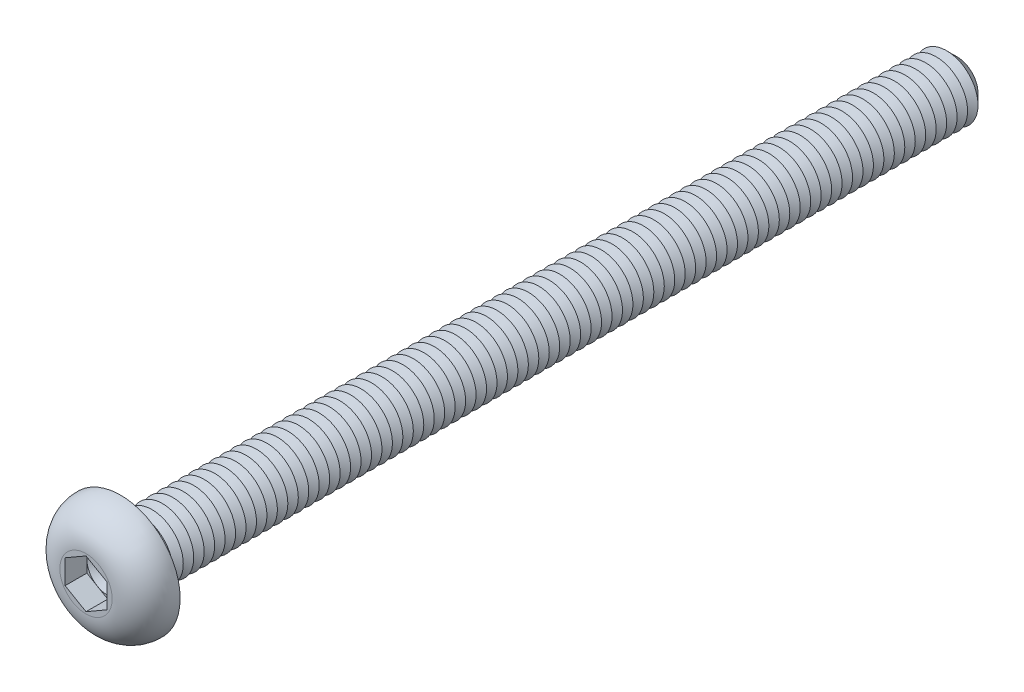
SolidWorks part; units mm, degrees
ref_plane "Front Plane" through (0, 0, 0) normal (0, 0, 1) x (1, 0, 0)
ref_plane "Top Plane" through (0, 0, 0) normal (0, 1, 0) x (1, 0, 0)
ref_plane "Right Plane" through (0, 0, 0) normal (1, 0, 0) x (0, 0, -1)
sketch "Sketch1" plane through (0, 0, 0) normal (1, 0, 0) x (0, 0, -1)
  line L0 (-47.9342, 0) -> (60.3146, 0) construction
sketch "Sketch2" plane through (0, 0, 0) normal (1, 0, 0) x (0, 0, -1)
  line L0 (0, 0) -> (-1.65, 0)
  line L1 (-47.9342, 0) -> (60.3146, 0) construction
  line L2 (-1.65, 0) -> (-1.65, 1.2508)
  line L3 (0, 2.85) -> (0, 0)
  arc A0 (-1.65, 1.2508) -> (0, 2.85) centre (-0.05, 1.2508) cw
  dimension "D1" = 1.6
  dimension "D2" = 1.65
  dimension "D3" = 2.85
revolve "Revolve1" add sketch "Sketch2" angle 360 about L0
sketch "Sketch3" plane through (0, 0, 1.65) normal (0, 0, 1) x (1, 0, 0)
  line L1 (0, 1.1547) -> (-1, 0.5774)
  line L2 (-1, 0.5774) -> (-1, -0.5774)
  line L3 (-1, -0.5774) -> (0, -1.1547)
  line L4 (0, -1.1547) -> (1, -0.5774)
  line L5 (1, -0.5774) -> (1, 0.5774)
  line L6 (1, 0.5774) -> (0, 1.1547)
  circle A0 centre (0, 0) radius 1 construction
  dimension "D1" = 2
extrude "Cut-Extrude1" cut sketch "Sketch3" against normal blind 1.04
sketch "Sketch4" plane through (0, 0, 0) normal (0, 0, -1) x (-1, 0, 0)
  circle A0 centre (0, 0) radius 1.5
  dimension "D1" = 3
extrude "Boss-Extrude1" add sketch "Sketch4" along normal blind 40
chamfer "Chamfer1" distance 0.5 angle 45 1 edges at (-1.5, 0, -40)
sketch "Sketch5" plane through (0, 0, 0) normal (1, 0, 0) x (0, 0, -1)
  line L0 (0.5, 1.5) -> (1, 1.5)
  line L1 (39.5, 1.5) -> (0, 1.5) construction
  line L2 (1, 1.5) -> (0.75, 1.067)
  line L3 (0.75, 1.067) -> (0.5, 1.5)
  line L4 (0, -2.85) -> (0, 2.85) construction
  line L5 (39.5, 1.5) -> (0, 1.5) construction
  dimension "D1" = 0.5
  dimension "D2" = 0.5
revolve "Cut-Revolve1" cut sketch "Sketch5" angle 360 about L0
pattern_linear "LPattern1" count 78 spacing 0.5 along (0, 0, -1) of "Cut-Revolve1"
fillet "Fillet2" radius 0.2 1 edges at (1.5, 0, 0)
sketch "Sketch6" plane through (0, 0, 0.61) normal (0, 0, 1) x (1, 0, 0)
  line L0 (0, -1.1547) -> (1, -0.5774) construction
  circle A0 centre (0, 0) radius 1
extrude "Cut-Extrude2" cut sketch "Sketch6" against normal through all draft 60
